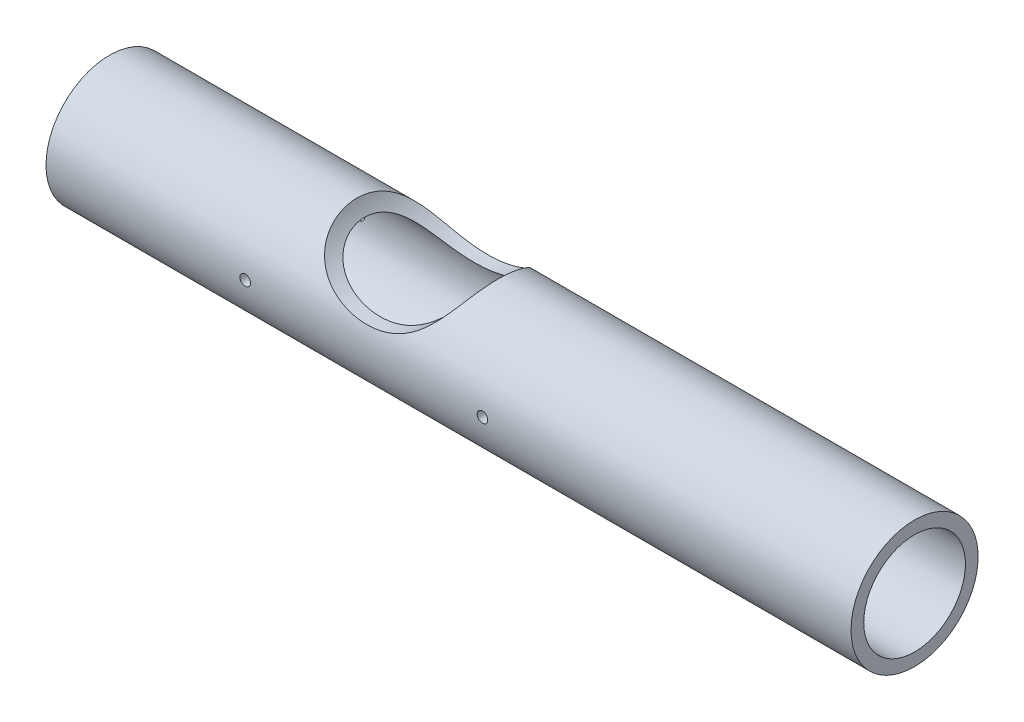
SolidWorks part; units mm, degrees
ref_plane "Face" through (0, 0, 0) normal (0, 0, 1) x (1, 0, 0)
ref_plane "Dessus" through (0, 0, 0) normal (0, 1, 0) x (1, 0, 0)
ref_plane "Droite" through (0, 0, 0) normal (1, 0, 0) x (0, 0, -1)
sketch "Esquisse1" plane through (0, 0, 0) normal (0, 0, 1) x (1, 0, 0)
  line L0 (-13.4437, 0) -> (136.5563, 0) construction
  line L1 (-11.8177, 15) -> (73.1823, 15)
  line L2 (-11.8177, 12) -> (178.1823, 12)
  line L3 (-11.8177, 15) -> (-11.8177, 12)
  line L7 (73.1823, 15) -> (178.1823, 15)
  line L8 (178.1823, 15) -> (178.1823, 12)
  dimension "D2" = 190
revolve "Base-Révolution" add sketch "Esquisse1" angle 360 about L0
sketch "Esquisse2" plane through (0, 0, 0) normal (0, 0, 1) x (1, 0, 0)
  line L0 (-13.4437, 0) -> (136.5563, 0) construction
  line L1 (-11.8177, 15) -> (-11.8177, -15) construction
  line L2 (178.1823, -15) -> (178.1823, 15) construction
  circle A0 centre (35.1823, 0) radius 1.25
  circle A1 centre (91.1823, 0) radius 1.25
  dimension "D1" = 2.5
  dimension "D2" = 2.5
  dimension "D3" = 47
  dimension "D4" = 87
extrude "Enlèv. mat.-Extru.1" cut sketch "Esquisse2" against normal mid plane 34
sketch "Esquisse3" plane through (0, 0, 0) normal (0, 0, 1) x (1, 0, 0)
  line L2 (178.1823, 15) -> (-11.8177, 15) construction
  line L4 (46.1823, 30.1226) -> (80.1823, 30.1226)
  arc A5 (46.1823, 30.1226) -> (80.1823, 30.1226) centre (63.1823, 23) ccw
  circle A9 centre (35.1823, 0) radius 1.25 construction
  circle A10 centre (91.1823, 0) radius 1.25 construction
  dimension "D1" = 11
  dimension "D2" = 11
  dimension "D3" = 8
extrude "Enlèv. mat.-Extru.2" cut sketch "Esquisse3" against normal mid plane 30
